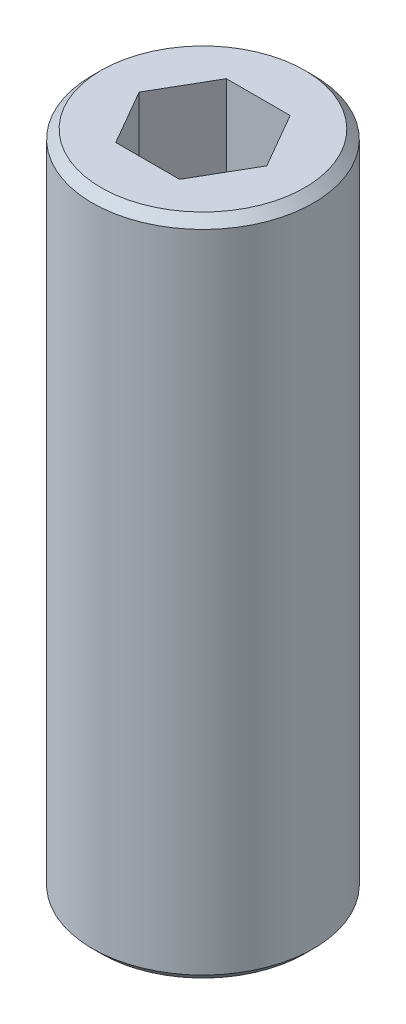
SolidWorks part; units mm, degrees
ref_plane "Front Plane" through (0, 0, 0) normal (0, 0, 1) x (1, 0, 0)
ref_plane "Top Plane" through (0, 0, 0) normal (0, 1, 0) x (1, 0, 0)
ref_plane "Right Plane" through (0, 0, 0) normal (1, 0, 0) x (0, 0, -1)
sketch "Sketch2" plane through (0, 0, 0) normal (0, 0, 1) x (1, 0, 0)
  line L0 (0, 0) -> (-2.921, 0)
  line L1 (-2.921, 0) -> (-3.175, -0.254)
  line L2 (-3.175, -0.254) -> (-3.175, -18.796)
  line L3 (-3.175, -18.796) -> (-2.921, -19.05)
  line L4 (-2.921, -19.05) -> (0, -18.7944)
  line L5 (0, 0) -> (0, -18.7944) construction
  line L6 (0, 0) -> (0, -18.7944)
  dimension "D1" = 3.175
  dimension "D2" = 135
  dimension "D3" = 95
  dimension "D4" = 130
  dimension "D5" = 19.05
  dimension "D6" = 0.254
revolve "Revolve1" add sketch "Sketch2" angle 360 about L5
sketch "Sketch3" plane through (0, 0, 0) normal (0, 1, 0) x (1, 0, 0)
  line L1 (-0.9165, -1.5875) -> (0.9165, -1.5875)
  line L2 (0.9165, -1.5875) -> (1.8331, 0)
  line L3 (1.8331, 0) -> (0.9165, 1.5875)
  line L4 (0.9165, 1.5875) -> (-0.9165, 1.5875)
  line L5 (-0.9165, 1.5875) -> (-1.8331, 0)
  line L6 (-1.8331, 0) -> (-0.9165, -1.5875)
  circle A0 centre (0, 0) radius 1.5875 construction
  point P10 (0, 0)
  dimension "D1" = 3.175
extrude "Cut-Extrude1" cut sketch "Sketch3" against normal blind 2.54
